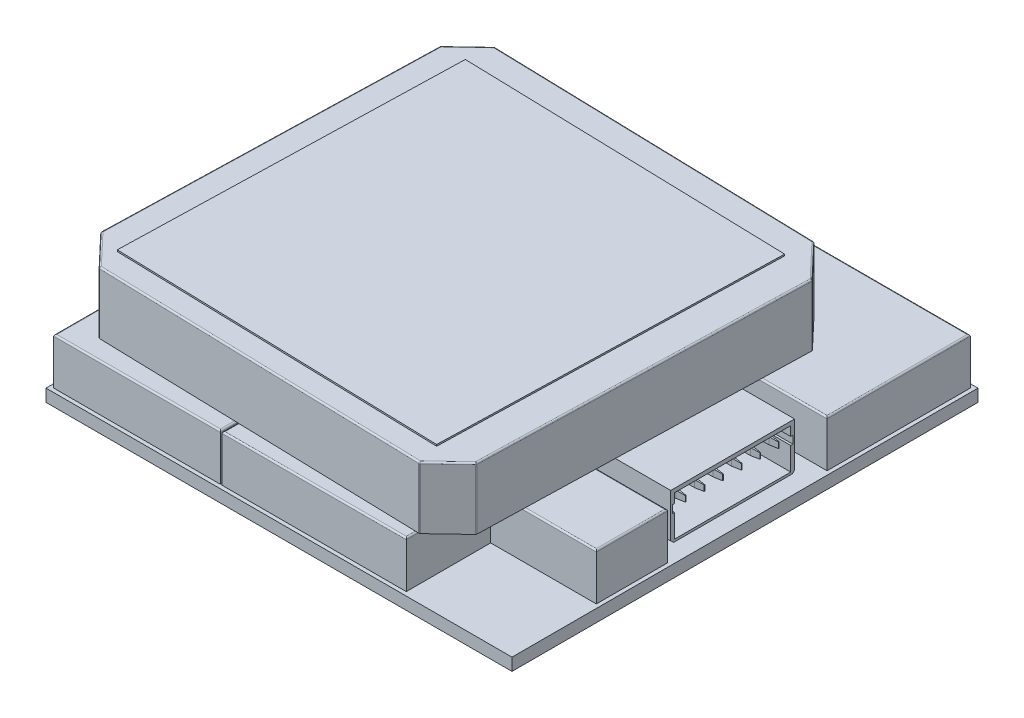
SolidWorks part; units mm, degrees
ref_plane "Front Plane" through (0, 0, 0) normal (0, 0, 1) x (1, 0, 0)
ref_plane "Top Plane" through (0, 0, 0) normal (0, 1, 0) x (1, 0, 0)
ref_plane "Right Plane" through (0, 0, 0) normal (1, 0, 0) x (0, 0, -1)
sketch "Sketch1" plane through (0, 0, 0) normal (0, 1, 0) x (1, 0, 0)
  line L1 (0, 0) -> (30.1, 0)
  line L2 (0, 0) -> (0, 30.1)
  line L3 (0, 30.1) -> (30.1, 30.1)
  line L4 (30.1, 0) -> (30.1, 30.1)
  dimension "D1" = 30.1
  dimension "D2" = 30.1
extrude "Boss-Extrude1" add sketch "Sketch1" along normal blind 0.8
sketch "Sketch2" plane through (0, 0.8, 0) normal (0, 1, 0) x (1, 0, 0)
  line L0 (29.85, 29.85) -> (0.25, 29.85)
  line L1 (0.25, 29.85) -> (0.25, 0.25) construction
  line L2 (0.25, 0.25) -> (11.0214, 0.25)
  line L3 (11.0214, 0.25) -> (11.0214, 17.85)
  line L4 (11.0214, 17.85) -> (0.25, 17.85)
  line L5 (29.85, 29.85) -> (29.85, 20.6)
  line L6 (29.85, 20.6) -> (23.0214, 20.6)
  line L7 (23.0214, 20.6) -> (23.0214, 10.3)
  line L8 (23.0214, 10.3) -> (29.85, 10.3)
  line L9 (29.85, 10.3) -> (29.85, 5.7)
  line L10 (29.85, 5.7) -> (23.0214, 5.7)
  line L11 (23.0214, 5.7) -> (23.0214, 0.25)
  line L12 (23.0214, 0.25) -> (11.1214, 0.25)
  line L13 (30.1, 0) -> (30.1, 30.1) construction
  line L14 (30.1, 30.1) -> (0, 30.1) construction
  line L15 (0, 30.1) -> (0, 0) construction
  line L16 (0, 0) -> (30.1, 0) construction
  line L17 (11.1214, 0.25) -> (11.1214, 17.95)
  line L18 (11.1214, 17.95) -> (0.25, 17.95)
  line L19 (0.25, 17.95) -> (0.25, 29.85)
  line L20 (0.25, 17.85) -> (0.25, 0.25)
  dimension "D1" = 4.6
  dimension "D2" = 10.3
  dimension "D3" = 9.25
  dimension "D4" = 12
  dimension "D5" = 0.25
  dimension "D6" = 0.25
  dimension "D7" = 0.25
  dimension "D8" = 0.25
  dimension "D9" = 17.6
  dimension "D10" = 0.1
  dimension "D11" = 0.1
extrude "Boss-Extrude2" add sketch "Sketch2" along normal blind 3
fillet "Fillet1" radius 0.1 16 edges at (5.6357, 3.8, -0.25) (0.25, 3.8, -9.05) (5.6357, 3.8, -17.85) (11.0214, 3.8, -9.05) (26.4357, 3.8, -20.6) (23.0214, 3.8, -15.45) (26.4357, 3.8, -10.3) (29.85, 3.8, -8) (26.4357, 3.8, -5.7) (23.0214, 3.8, -2.975) (17.0714, 3.8, -0.25) (11.1214, 3.8, -9.1) (5.6857, 3.8, -17.95) (0.25, 3.8, -23.9) (15.05, 3.8, -29.85) (29.85, 3.8, -25.225)
sketch "Sketch3" plane through (0, 0.8, 0) normal (0, 1, 0) x (1, 0, 0)
  line L0 (23.0214, 15.45) -> (30.1, 15.45) construction
  line L1 (23.0214, 10.3) -> (23.0214, 20.6) construction
  line L2 (30.1, 0) -> (30.1, 30.1) construction
  line L4 (23.5093, 11.45) -> (23.9026, 11.45)
  line L5 (23.5093, 11.45) -> (23.5093, 19.45)
  line L6 (23.5093, 19.45) -> (23.9026, 19.45)
  line L7 (23.9026, 11.45) -> (23.9026, 19.45)
  line L8 (23.5093, 11.45) -> (23.9026, 19.45) construction
  line L9 (23.5093, 19.45) -> (23.9026, 11.45) construction
  point P6 (23.706, 15.45)
  dimension "D1" = 8
extrude "Boss-Extrude3" add sketch "Sketch3" along normal blind 3
sketch "Sketch4" plane through (23.9026, 0, 0) normal (1, 0, 0) x (0, 0, -1)
  line L0 (15.45, 3.8) -> (15.45, 0.8) construction
  line L1 (11.45, 3.8) -> (19.45, 3.8) construction
  line L2 (11.45, 0.8) -> (19.45, 0.8) construction
  line L3 (11.7, 3.55) -> (19.2, 3.55)
  line L4 (19.2, 3.55) -> (19.2, 2.9439)
  line L5 (19.2, 2.9439) -> (19.3396, 2.9439)
  line L6 (19.3396, 2.9439) -> (19.3396, 2.4439)
  line L7 (19.3396, 2.4439) -> (19.2, 2.4439)
  line L8 (19.2, 2.4439) -> (19.2, 0.9542)
  line L9 (19.2, 0.9542) -> (11.7, 0.9542)
  line L10 (19.45, 3.8) -> (19.45, 0.8) construction
  line L11 (11.7, 2.4439) -> (11.7, 0.9542)
  line L12 (11.5604, 2.4439) -> (11.7, 2.4439)
  line L13 (11.5604, 2.9439) -> (11.5604, 2.4439)
  line L14 (11.7, 2.9439) -> (11.5604, 2.9439)
  line L15 (11.7, 3.55) -> (11.7, 2.9439)
  line L16 (11.45, 3.8) -> (19.45, 3.8)
  line L17 (19.45, 3.8) -> (19.45, 0.9542)
  line L18 (19.45, 0.9542) -> (19.3102, 0.8)
  line L19 (19.3102, 0.8) -> (11.6451, 0.8)
  line L20 (11.6451, 0.8) -> (11.45, 0.9769)
  line L21 (11.45, 3.8) -> (11.45, 0.8) construction
  line L22 (11.45, 0.9769) -> (11.45, 3.8)
  point P17 (15.45, 0.9542)
  point P22 (15.45, 3.55)
  dimension "D1" = 0.25
  dimension "D2" = 0.25
  dimension "D3" = 0.25
  dimension "D4" = 0.5
extrude "Boss-Extrude4" add sketch "Sketch4" along normal blind 5
sketch "Sketch5" plane through (23.9026, 0, 0) normal (1, 0, 0) x (0, 0, -1)
  line L0 (15.45, 3.55) -> (15.45, 0.9542) construction
  line L1 (19.2, 3.55) -> (11.7, 3.55) construction
  line L2 (11.7, 0.9542) -> (19.2, 0.9542) construction
  line L3 (11.9679, 2.8428) -> (18.9321, 2.8428) construction
  line L4 (13.5601, 3.0717) -> (13.6993, 3.0717)
  line L5 (12.3601, 3.0717) -> (12.4993, 3.0717)
  line L6 (12.3601, 3.0717) -> (12.3601, 2.6138)
  line L7 (12.3601, 2.6138) -> (12.4993, 2.6138)
  line L8 (12.4993, 3.0717) -> (12.4993, 2.6138)
  line L9 (13.5601, 3.0717) -> (13.5601, 2.6138)
  line L10 (13.5601, 2.6138) -> (13.6993, 2.6138)
  line L11 (13.6993, 3.0717) -> (13.6993, 2.6138)
  line L12 (14.7601, 3.0717) -> (14.8993, 3.0717)
  line L13 (14.7601, 3.0717) -> (14.7601, 2.6138)
  line L14 (14.7601, 2.6138) -> (14.8993, 2.6138)
  line L15 (14.8993, 3.0717) -> (14.8993, 2.6138)
  line L16 (15.9601, 3.0717) -> (16.0993, 3.0717)
  line L17 (15.9601, 3.0717) -> (15.9601, 2.6138)
  line L18 (15.9601, 2.6138) -> (16.0993, 2.6138)
  line L19 (16.0993, 3.0717) -> (16.0993, 2.6138)
  line L20 (17.1601, 3.0717) -> (17.2993, 3.0717)
  line L21 (17.1601, 3.0717) -> (17.1601, 2.6138)
  line L22 (17.1601, 2.6138) -> (17.2993, 2.6138)
  line L23 (17.2993, 3.0717) -> (17.2993, 2.6138)
  line L24 (18.3601, 3.0717) -> (18.4993, 3.0717)
  line L25 (18.3601, 3.0717) -> (18.3601, 2.6138)
  line L26 (18.3601, 2.6138) -> (18.4993, 2.6138)
  line L27 (18.4993, 3.0717) -> (18.4993, 2.6138)
  dimension "D1" = 6
extrude "Boss-Extrude5" add sketch "Sketch5" along normal blind 5
chamfer "Chamfer1" distance 0.05 angle 85 24 edges at (28.9026, 3.0717, -12.4297) (28.9026, 2.8428, -12.4993) (28.9026, 2.6138, -12.4297) (28.9026, 2.8428, -12.3601) (28.9026, 3.0717, -13.6297) (28.9026, 2.8428, -13.6993) (28.9026, 2.6138, -13.6297) (28.9026, 2.8428, -13.5601) (28.9026, 3.0717, -14.8297) (28.9026, 2.8428, -14.8993) (28.9026, 2.6138, -14.8297) (28.9026, 2.8428, -14.7601) (28.9026, 3.0717, -16.0297) (28.9026, 2.8428, -16.0993) (28.9026, 2.6138, -16.0297) (28.9026, 2.8428, -15.9601) (28.9026, 3.0717, -17.2297) (28.9026, 2.8428, -17.2993) (28.9026, 2.6138, -17.2297) (28.9026, 2.8428, -17.1601) (28.9026, 3.0717, -18.4297) (28.9026, 2.8428, -18.4993) (28.9026, 2.6138, -18.4297) (28.9026, 2.8428, -18.3601)
sketch "Sketch6" plane through (0, 3.8, 0) normal (0, 1, 0) x (1, 0, 0)
  line L0 (2.3842, 26.5955) -> (23.5971, 26.02)
  line L1 (23.5971, 26.02) -> (25.6601, 23.8419)
  line L2 (25.6601, 23.8419) -> (25.0867, 2.7077)
  line L3 (25.0867, 2.7077) -> (23.2009, 0.9215)
  line L4 (23.2009, 0.9215) -> (1.9326, 1.4986)
  line L5 (1.9326, 1.4986) -> (0, 3.539)
  line L6 (0, 3.539) -> (0.5792, 24.8859)
  line L7 (0.5792, 24.8859) -> (2.3842, 26.5955)
  dimension "D1" = 25.1
  dimension "D2" = 25.1
  dimension "D3" = 135
  dimension "D4" = 135
  dimension "D5" = 3
extrude "Boss-Extrude6" add sketch "Sketch6" along normal blind 4
sketch "Sketch7" plane through (0, 7.8, 0) normal (0, 1, 0) x (1, 0, 0)
  line L0 (2.2599, 24.825) -> (23.4626, 24.2497)
  line L1 (2.2599, 24.825) -> (1.666, 2.9373)
  line L2 (23.4626, 24.2497) -> (22.8688, 2.362)
  line L3 (1.666, 2.9373) -> (22.8688, 2.362)
  line L4 (0.5792, 24.8859) -> (0, 3.539) construction
  line L5 (23.5971, 26.02) -> (2.3842, 26.5955) construction
extrude "Boss-Extrude7" add sketch "Sketch7" along normal blind 0.1
fillet "Fillet2" radius 0.1 16 edges at (0, 5.8, -3.539) (1.9326, 5.8, -1.4986) (25.0867, 5.8, -2.7077) (23.2009, 5.8, -0.9215) (25.6601, 5.8, -23.8419) (23.5971, 5.8, -26.02) (0.5792, 5.8, -24.8859) (2.3842, 5.8, -26.5955) (12.9906, 7.8, -26.3078) (1.4817, 7.8, -25.7407) (0.2896, 7.8, -14.2124) (24.6286, 7.8, -24.931) (25.3734, 7.8, -13.2748) (24.1438, 7.8, -1.8146) (0.9663, 7.8, -2.5188) (12.5667, 7.8, -1.21)
